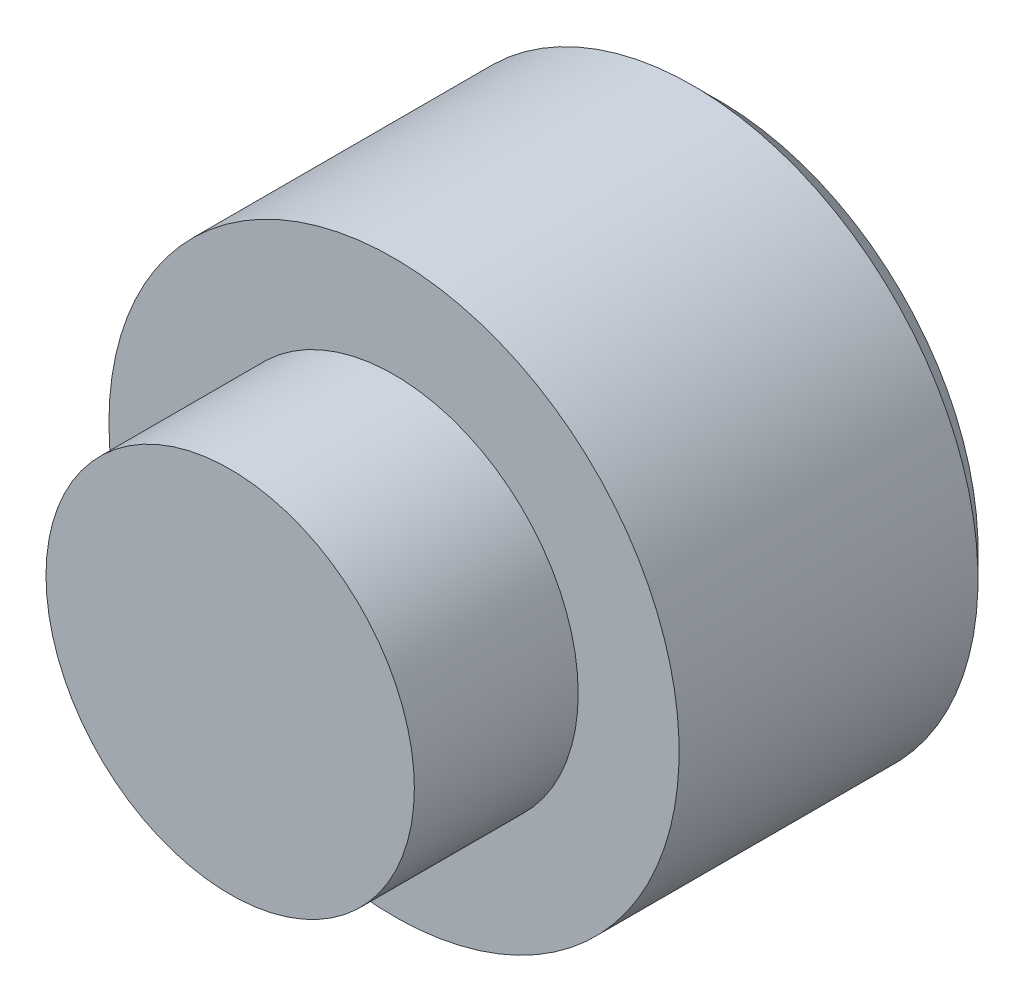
SolidWorks part; units mm, degrees
ref_plane "Front Plane" through (0, 0, 0) normal (0, 0, 1) x (1, 0, 0)
ref_plane "Top Plane" through (0, 0, 0) normal (0, 1, 0) x (1, 0, 0)
ref_plane "Right Plane" through (0, 0, 0) normal (1, 0, 0) x (0, 0, -1)
sketch "Sketch1" plane through (0, 0, 0) normal (0, 0, 1) x (1, 0, 0)
  circle A0 centre (0, 0) radius 3.5687
  dimension "D1" = 7.1374
extrude "Boss-Extrude1" add sketch "Sketch1" along normal blind 3.175
sketch "Sketch2" plane through (0, 0, 0) normal (0, 0, -1) x (-1, 0, 0)
  circle A0 centre (0, 0) radius 5.5245
  dimension "D1" = 11.049
extrude "Boss-Extrude2" add sketch "Sketch2" along normal blind 6.2992
chamfer "Chamfer1" distance 0.508 angle 45 1 edges at (-5.5245, 0, -6.2992)
